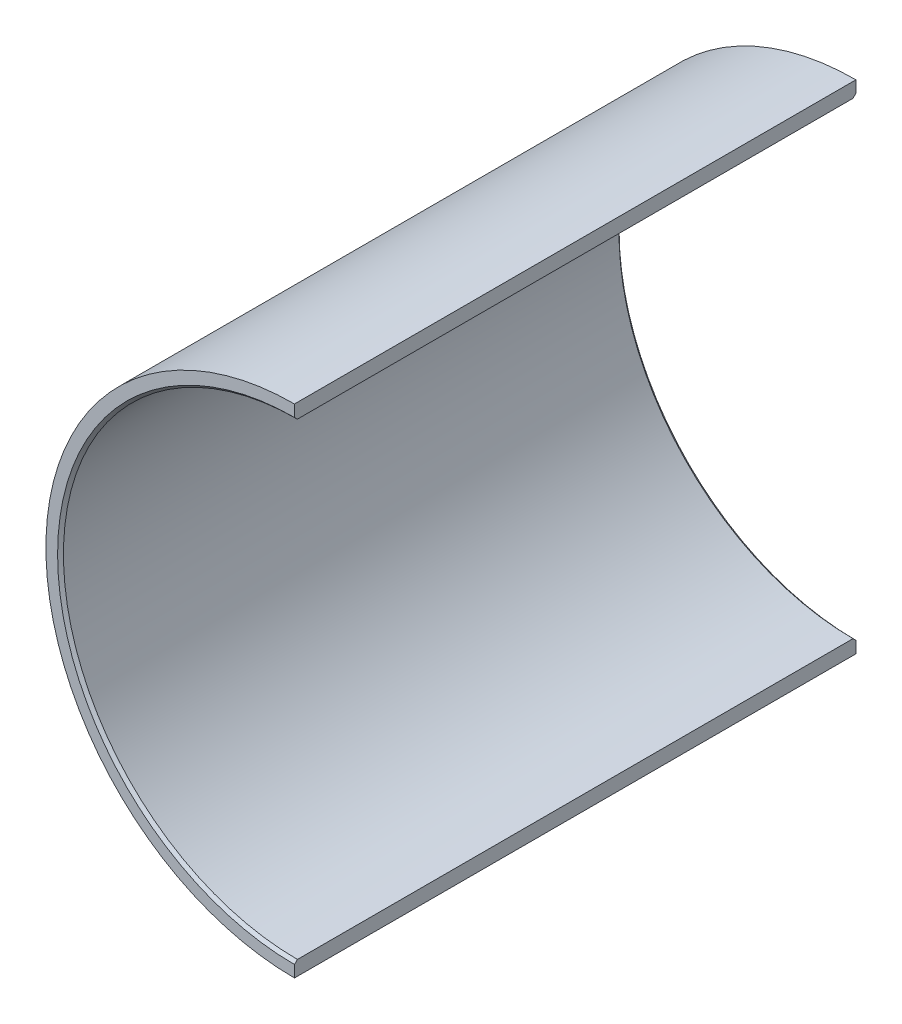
SolidWorks part; units mm, degrees
ref_plane "Plan1" through (0, 0, 0) normal (0, 0, 1) x (1, 0, 0)
ref_plane "Plan2" through (0, 0, 0) normal (0, 1, 0) x (1, 0, 0)
ref_plane "Plan3" through (0, 0, 0) normal (1, 0, 0) x (0, 0, -1)
sketch "Esquisse1" plane through (0, 0, 0) normal (0, 0, 1) x (1, 0, 0)
  circle A0 centre (0, 0) radius 40
  circle A1 centre (0, 0) radius 42.5
  dimension "D1" = 85
  dimension "D2" = 80
extrude "Base-Extrusion" add sketch "Esquisse1" against normal blind 96
chamfer "Chanfrein1" distance 0.5 angle 45
sketch "Esquisse2" plane through (0, 0, 0) normal (1, 0, 0) x (0, 0, -1)
  line L1 (-10, 80) -> (150, 80)
  line L2 (-10, 80) -> (-10, -70)
  line L3 (-10, -70) -> (150, -70)
  line L4 (150, 80) -> (150, -70)
extrude "Enlèv. mat.-Extru.1" cut sketch "Esquisse2" along normal blind 79
